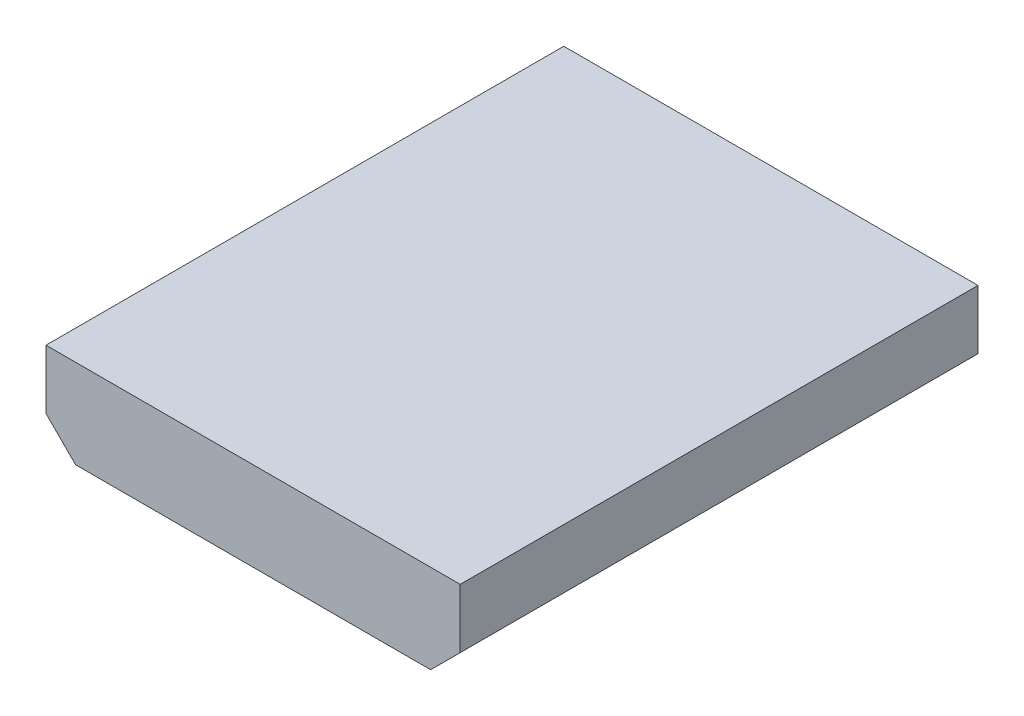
SolidWorks part; units mm, degrees
ref_plane "Front Plane" through (0, 0, 0) normal (0, 0, 1) x (1, 0, 0)
ref_plane "Top Plane" through (0, 0, 0) normal (0, 1, 0) x (1, 0, 0)
ref_plane "Right Plane" through (0, 0, 0) normal (1, 0, 0) x (0, 0, -1)
sketch "Sketch1" plane through (0, 0, 0) normal (0, 0, 1) x (1, 0, 0)
  line L1 (-6, 0) -> (-7, 0)
  line L2 (-7, 0) -> (-7, -2)
  line L3 (-7, -2) -> (-6, -3)
  line L7 (6, -3) -> (7, -2)
  line L8 (7, -2) -> (7, 0)
  line L9 (7, 0) -> (6, 0)
  line L12 (-7, 0) -> (7, 0)
  line L13 (-6, -3) -> (6, -3)
extrude "Boss-Extrude1" add sketch "Sketch1" along normal mid plane 17.5 contours L3 L13 L7 L8 L9 L12 L1 L2
